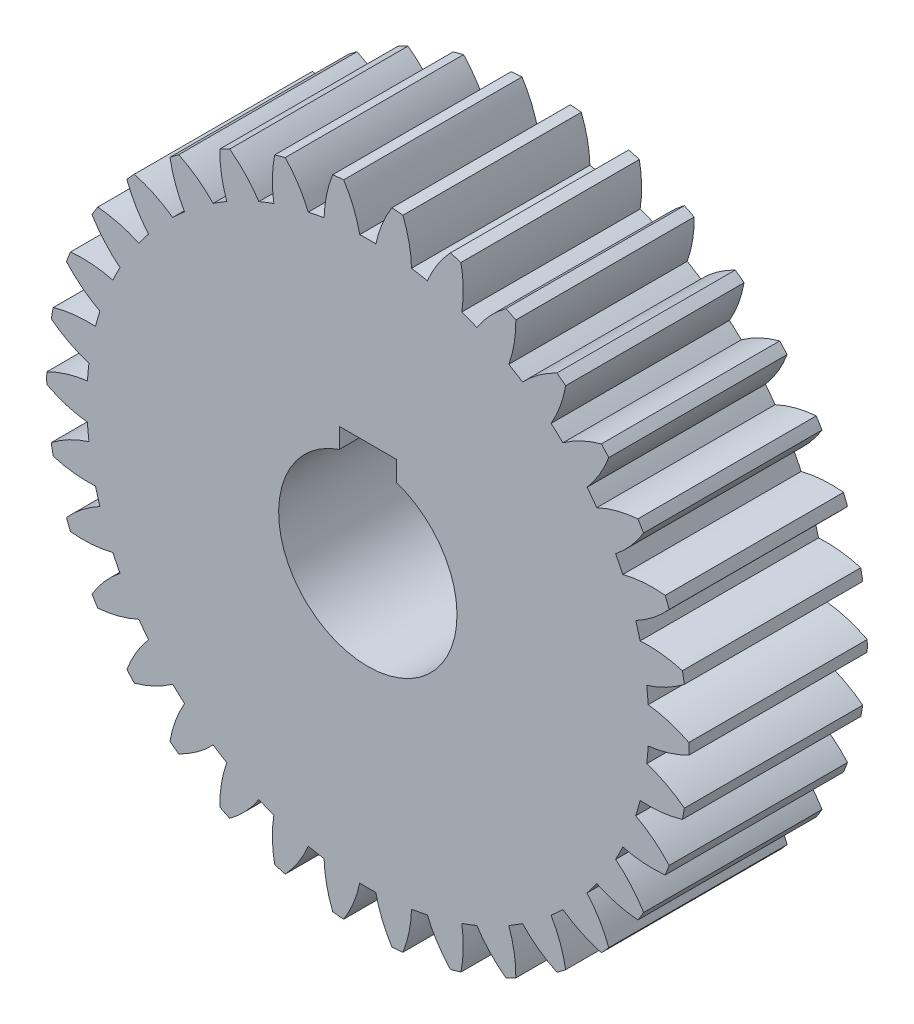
SolidWorks part; units mm, degrees
ref_plane "Front" through (0, 0, 0) normal (0, 0, 1) x (1, 0, 0)
ref_plane "Top" through (0, 0, 0) normal (0, 1, 0) x (1, 0, 0)
ref_plane "Right" through (0, 0, 0) normal (1, 0, 0) x (0, 0, -1)
sketch "Sketch1" plane through (0, 0, 0) normal (0, 0, 1) x (1, 0, 0)
  circle A0 centre (0, 0) radius 90
  dimension "D1" = 180
extrude "Boss-Extrude1" add sketch "Sketch1" along normal blind 50
sketch "Sketch2" plane through (0, 0, 50) normal (0, 0, 1) x (1, 0, 0)
  line L0 (0, 0) -> (0, 114.6506) construction
  line L1 (0, 0) -> (-11.9398, 128.8541) construction
  line L2 (0, 0) -> (-4.218, 84.8953) construction
  circle A0 centre (0, 0) radius 85 construction
  arc A1 (2.2545, 78.7167) -> (-2.2545, 78.7167) centre (0, 0) ccw
  circle A2 centre (0, 0) radius 90 construction
  arc A3 (6.7666, 89.7453) -> (-6.7666, 89.7453) centre (0, 0) ccw
  arc A4 (-6.7666, 89.7453) -> (-2.2545, 78.7167) centre (-35.4918, 71.5555) cw
  arc A5 (6.7666, 89.7453) -> (2.2545, 78.7167) centre (35.4918, 71.5555) ccw
  circle A6 centre (0, 0) radius 79.874 construction
  dimension "D1" = 34
  dimension "D2" = 157.498
  dimension "D3" = 170
  dimension "D4" = 159.748
  dimension "D5" = 5.294
  dimension "D6" = 3.633
extrude "Cut-Extrude1" cut sketch "Sketch2" against normal up to next
pattern_circular "CirPattern1" count 34 over 360 about axis through (0, 0, 0) along (0, 0, 1) of "Cut-Extrude1"
sketch "Sketch3" plane through (0, 0, 50) normal (0, 0, 1) x (1, 0, 0)
  line L0 (0, 0) -> (0, 124.4018) construction
  line L1 (-8, 29.3) -> (8, 29.3)
  line L2 (-8, 29.3) -> (-8, 23.6854)
  line L4 (8, 29.3) -> (8, 23.6854)
  arc A0 (-8, 23.6854) -> (8, 23.6854) centre (0, 0) ccw
  dimension "D1" = 25
  dimension "D2" = 29.3
  dimension "D3" = 16
extrude "Cut-Extrude2" cut sketch "Sketch3" against normal blind 50
